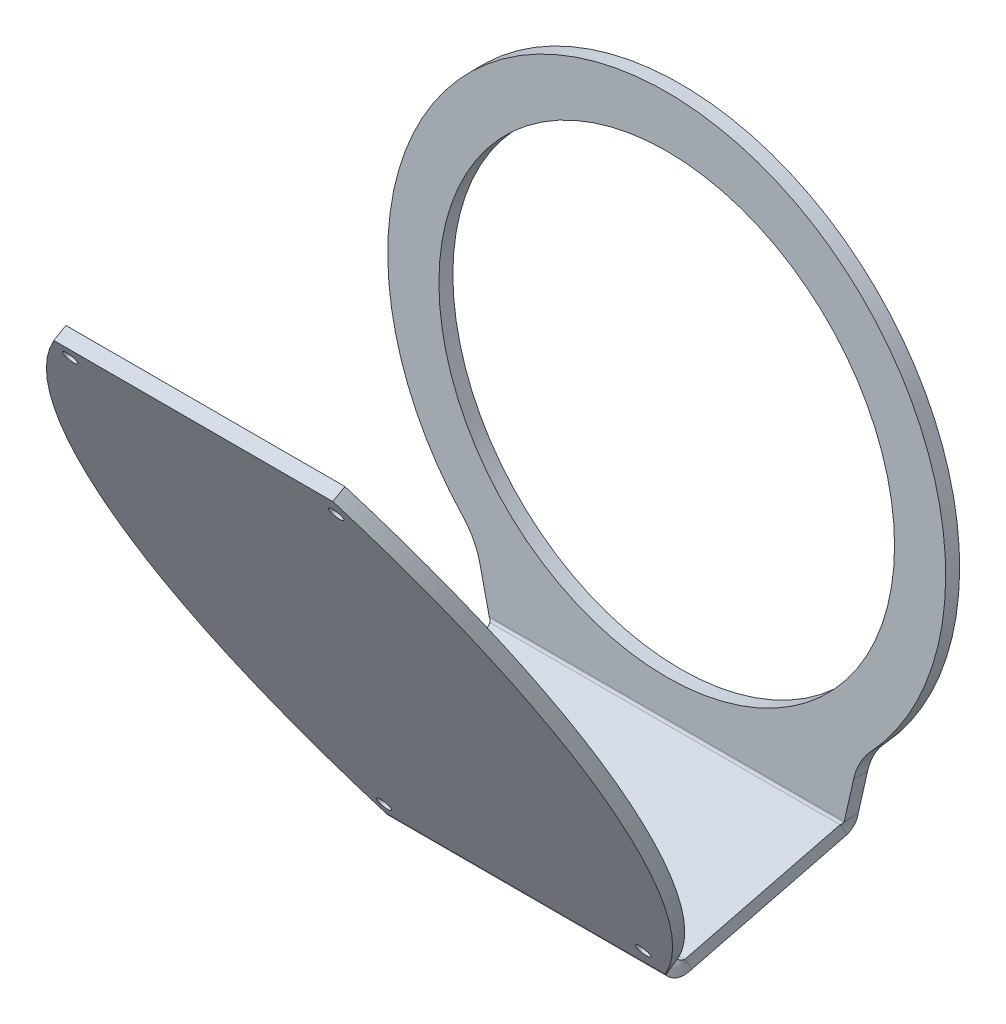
SolidWorks part; units mm, degrees
ref_plane "Plan de face" through (0, 0, 0) normal (0, 0, 1) x (1, 0, 0)
ref_plane "Plan de dessus" through (0, 0, 0) normal (0, 1, 0) x (1, 0, 0)
ref_plane "Plan de droite" through (0, 0, 0) normal (1, 0, 0) x (0, 0, -1)
sketch "Esquisse1" plane through (0, 0, 0) normal (0, 0, 1) x (1, 0, 0)
  line L0 (74.421, -175.5457) -> (14.421, -175.5457)
  line L1 (3.2792, 16.781) -> (85.5628, 16.781) construction
  line L2 (3.2792, 16.781) -> (14.421, -32.5457)
  line L5 (85.5628, 16.781) -> (74.421, -32.5457)
  line L6 (44.421, 60.4543) -> (44.421, -111.6731) construction
  arc A0 (85.5628, 16.781) -> (3.2792, 16.781) centre (44.421, 60.4543) ccw
  circle A1 centre (44.421, 60.4543) radius 49
  arc A2 (74.421, -32.5457) -> (74.421, -175.5457) centre (-26.583, -104.0457) cw
  arc A3 (14.421, -32.5457) -> (14.421, -175.5457) centre (115.425, -104.0457) ccw
  point P15 (44.421, -175.5457)
  dimension "D3" = 98
  dimension "D4" = 143
  dimension "D7" = 123.75
  dimension "D1" = 11
  dimension "D2" = 93
  dimension "D5" = 30
extrude "Extrusion1" add sketch "Esquisse1" along normal blind 3
sketch "Esquisse4" plane through (0, 0, 3) normal (0, 0, 1) x (1, 0, 0)
  line L1 (97.167, -104.0457) -> (-8.325, -104.0457) construction
  line L2 (12.421, 17.0009) -> (12.421, -214.8941) construction
  arc A0 (74.421, -175.5457) -> (74.421, -32.5457) centre (-26.583, -104.0457) ccw construction
  arc A1 (14.421, -32.5457) -> (14.421, -175.5457) centre (115.425, -104.0457) ccw construction
  circle A2 centre (72.421, -38.0457) radius 1.5
  circle A3 centre (15.921, -36.5457) radius 1.5
  circle A4 centre (72.421, -170.0457) radius 1.5
  circle A5 centre (15.921, -171.5457) radius 1.5
  dimension "D2" = 3
  dimension "D3" = 62
  dimension "D4" = 56.5
  dimension "D1" = 66
  dimension "D5" = 67.5
  dimension "D6" = 3.5
extrude "Enlèv. mat.-Extru.1" cut sketch "Esquisse4" against normal blind 10
fillet "Congé1" radius 15 2 edges at (3.2792, 16.781, 1.5) (85.5628, 16.781, 1.5)
sheet metal parameters "Tôlerie 1" parameters "D1"=0.7366
flatten bends "Dépliage 1" parameters "D1"=0
sketch "Esquisse-Angle1" plane through (0, 0, 3) normal (0, 0, 1) x (1, 0, 0)
process bends "Pliage 1" parameters "D1"=0
sketch "Esquisse-Plate1" plane through (0, 0, 3) normal (0, 0, 1) x (1, 0, 0)
sketch "Esquisse10" plane through (0, 0, 3) normal (0, 0, 1) x (1, 0, 0)
  line L0 (14.0822, -31.0457) -> (74.7598, -31.0457)
  line L1 (4.2281, 12.5801) -> (14.421, -32.5457) construction
  line L2 (74.421, -32.5457) -> (84.6139, 12.5801) construction
  dimension "D2" = 1.5
sketched bend "Pli esquissé1" parameters "D1"=0.7366
bend "Pli esquissé2" bend radius 0.7366 bend angle 90 parameters "D5"=1
sketch "Esquisse12" plane through (0, 0, 3) normal (0, 0, 1) x (1, 0, 0)
  line L0 (6.5153, 2.4543) -> (82.3267, 2.4543)
  line L1 (4.2281, 12.5801) -> (13.6854, -29.2891) construction
  line L2 (75.1566, -29.2891) -> (84.6139, 12.5801) construction
  circle A0 centre (44.421, 60.4543) radius 49 construction
  dimension "D1" = 58
sketched bend "Pli esquissé4" parameters "D1"=0.7366
bend "Pli esquissé5" bend radius 0.7366 bend angle 60 parameters "D5"=2
flat pattern "Etat déplié1"
sketch "Lignes de pliage1" plane through (0, 0, 0) normal (0, 1, 0) x (-1, 0, 0)
bend of the flat pattern "Dépliage-<Pli esquissé2>1"
bend of the flat pattern "Dépliage-<Pli esquissé5>1"
